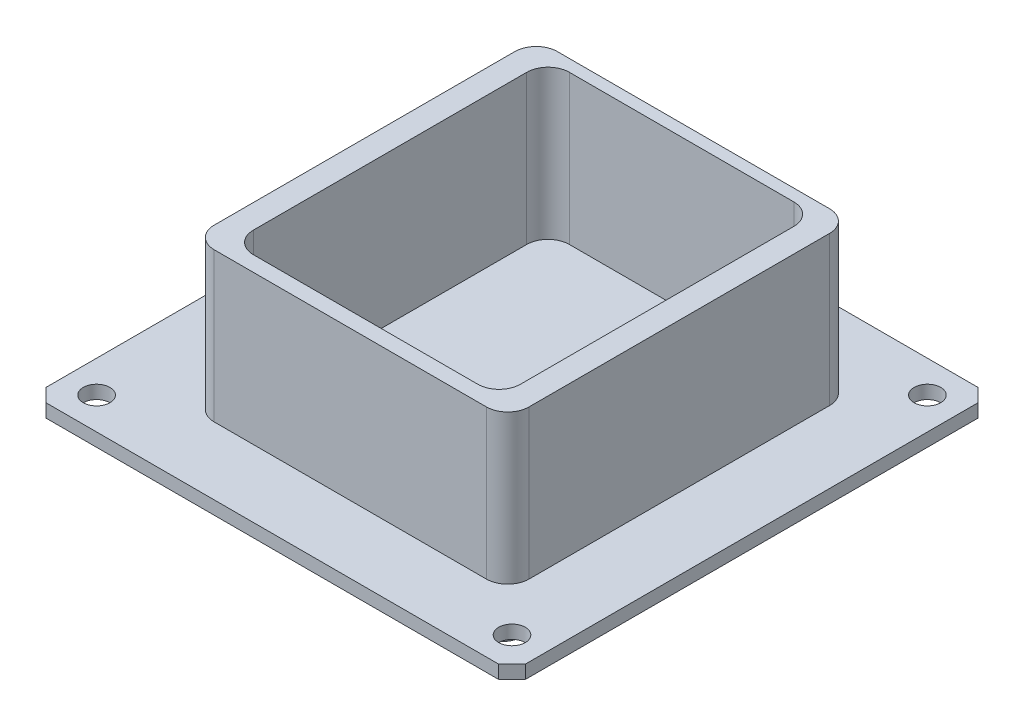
SolidWorks part; units mm, degrees
ref_plane "Front" through (0, 0, 0) normal (0, 0, 1) x (1, 0, 0)
ref_plane "Top" through (0, 0, 0) normal (0, 1, 0) x (1, 0, 0)
ref_plane "Right" through (0, 0, 0) normal (1, 0, 0) x (0, 0, -1)
sketch "Sketch1" plane through (0, 0, 0) normal (0, 1, 0) x (1, 0, 0)
  line L0 (28.575, 0) -> (28.575, 57.15) construction
  line L1 (1.5875, 0) -> (55.5625, 0)
  line L2 (0, 1.5875) -> (0, 55.5625)
  line L3 (1.5875, 57.15) -> (55.5625, 57.15)
  line L4 (57.15, 1.5875) -> (57.15, 55.5625)
  line L5 (57.15, 28.575) -> (0, 28.575) construction
  line L6 (55.5625, 57.15) -> (57.15, 55.5625)
  line L7 (0, 55.5625) -> (1.5875, 57.15)
  line L8 (0, 1.5875) -> (1.5875, 0)
  line L9 (55.5625, 0) -> (57.15, 1.5875)
  circle A0 centre (53.34, 3.81) radius 1.5875
  circle A1 centre (53.34, 53.34) radius 1.5875
  circle A2 centre (3.81, 53.34) radius 1.5875
  circle A3 centre (3.81, 3.81) radius 1.5875
  point P0 (0, 0)
  point P1 (57.15, 57.15)
  point P2 (0, 57.15)
  point P3 (57.15, 0)
  dimension "D3" = 3.175
  dimension "D1" = 57.15
  dimension "D2" = 57.15
  dimension "D4" = 24.765
  dimension "D5" = 24.765
  dimension "D8" = 1.5875
  dimension "D9" = 1.5875
  dimension "D10" = 1.5875
  dimension "D11" = 1.5875
extrude "Extrude1" add sketch "Sketch1" along normal blind 1.5875
sketch "Sketch2" plane through (0, 1.5875, 0) normal (0, 1, 0) x (1, 0, 0)
  line L1 (11.0524, 48.9698) -> (48.5913, 48.9698)
  line L2 (11.0524, 48.9698) -> (11.0524, 8.0466)
  line L3 (11.0524, 8.0466) -> (48.5913, 8.0466)
  line L4 (48.5913, 48.9698) -> (48.5913, 8.0466)
  line L5 (13.9023, 47.5448) -> (45.7414, 47.5448)
  line L6 (13.9023, 47.5448) -> (13.9023, 9.8723)
  line L7 (13.9023, 9.8723) -> (45.7414, 9.8723)
  line L8 (45.7414, 47.5448) -> (45.7414, 9.8723)
extrude "Extrude2" add sketch "Sketch2" along normal blind 17.78
sketch "Sketch3" plane through (0, 0, 0) normal (0, -1, 0) x (1, 0, 0)
  line L1 (12.8336, -8.4028) -> (47.4781, -8.4028)
  line L2 (12.8336, -8.4028) -> (12.8336, -50.4393)
  line L3 (12.8336, -50.4393) -> (47.4781, -50.4393)
  line L4 (47.4781, -8.4028) -> (47.4781, -50.4393)
extrude "Extrude3" add sketch "Sketch3" along normal blind 5.08
fillet "Fillet1" radius 2.54 12 edges at (13.9023, 10.4775, -9.8723) (45.7414, 10.4775, -9.8723) (13.9023, 10.4775, -47.5448) (48.5913, 10.4775, -48.9698) (11.0524, 10.4775, -48.9698) (48.5913, 10.4775, -8.0466) (11.0524, 10.4775, -8.0466) (45.7414, 10.4775, -47.5448) (12.8336, -2.54, -50.4393) (12.8336, -2.54, -8.4028) (47.4781, -2.54, -50.4393) (47.4781, -2.54, -8.4028)
